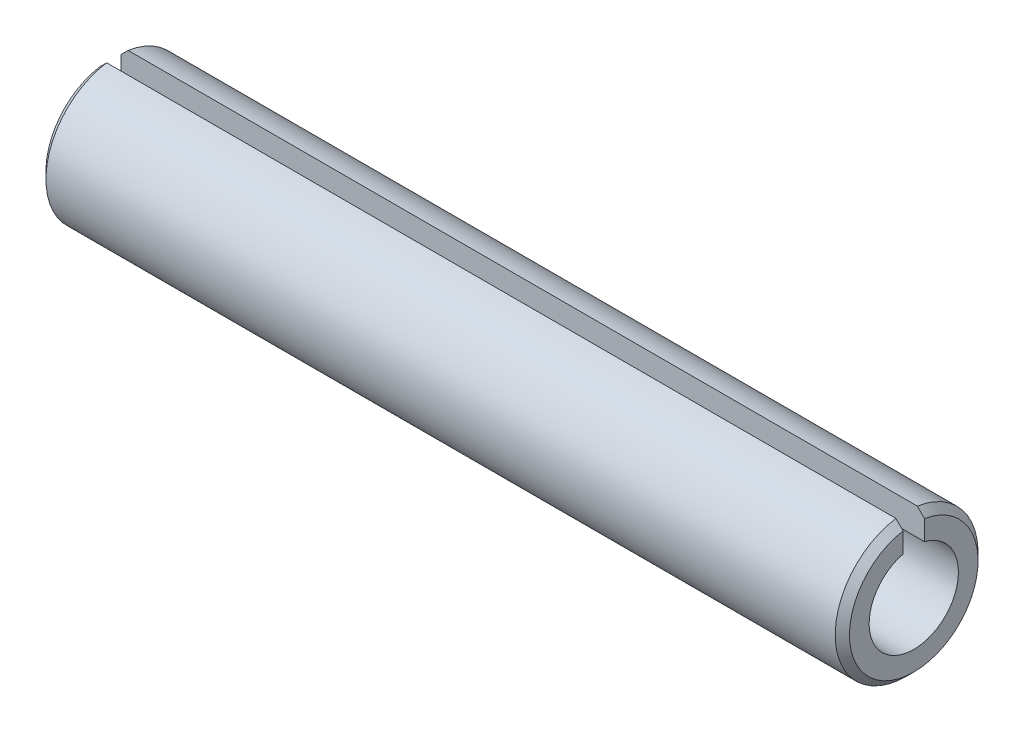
SolidWorks part; units mm, degrees
ref_plane "Plan1" through (0, 0, 0) normal (0, 0, 1) x (1, 0, 0)
ref_plane "Plan2" through (0, 0, 0) normal (0, 1, 0) x (1, 0, 0)
ref_plane "Plan3" through (0, 0, 0) normal (1, 0, 0) x (0, 0, -1)
sketch "Esquisse1" plane through (0, 0, 0) normal (0, 0, 1) x (1, 0, 0)
  line L0 (0, 2.5) -> (0, 3.6)
  line L1 (0, 2.5) -> (45, 2.5)
  line L2 (45, 2.5) -> (45, 3.6)
  line L3 (45, 3.6) -> (44.6, 4)
  line L4 (44.6, 4) -> (0.4, 4)
  line L5 (0.4, 4) -> (0, 3.6)
  line L6 (0, 0) -> (45, 0) construction
  dimension "D1" = 45
  dimension "D2" = 4
  dimension "D3" = 1.5
  dimension "D4" = 45
  dimension "D5" = 45
  dimension "D6" = 0.4
revolve "Base-Révolution" add sketch "Esquisse1" angle 360 about L6
sketch "Esquisse2" plane through (0, 0, 0) normal (1, 0, 0) x (0, 0, -1)
  line L0 (0, 0) -> (0, 4) construction
  line L1 (0.6, 3.9547) -> (0.6, 2.4269)
  line L2 (-0.6, 3.9547) -> (-0.6, 2.4269)
  circle A0 centre (0, 0) radius 4 construction
  circle A1 centre (0, 0) radius 2.5 construction
  arc A2 (0.6, 2.4269) -> (-0.6, 2.4269) centre (0, 0) ccw
  arc A3 (0.6, 3.9547) -> (-0.6, 3.9547) centre (0, 0) ccw
  dimension "D1" = 0.6
extrude "Enlèv. mat.-Extru.2" cut sketch "Esquisse2" along normal through all
equation "\"D6@Esquisse1\"=\"D2@Esquisse1\"/10"
equation "\"D1@Esquisse2\"=\"D3@Esquisse1\"/2.5"
